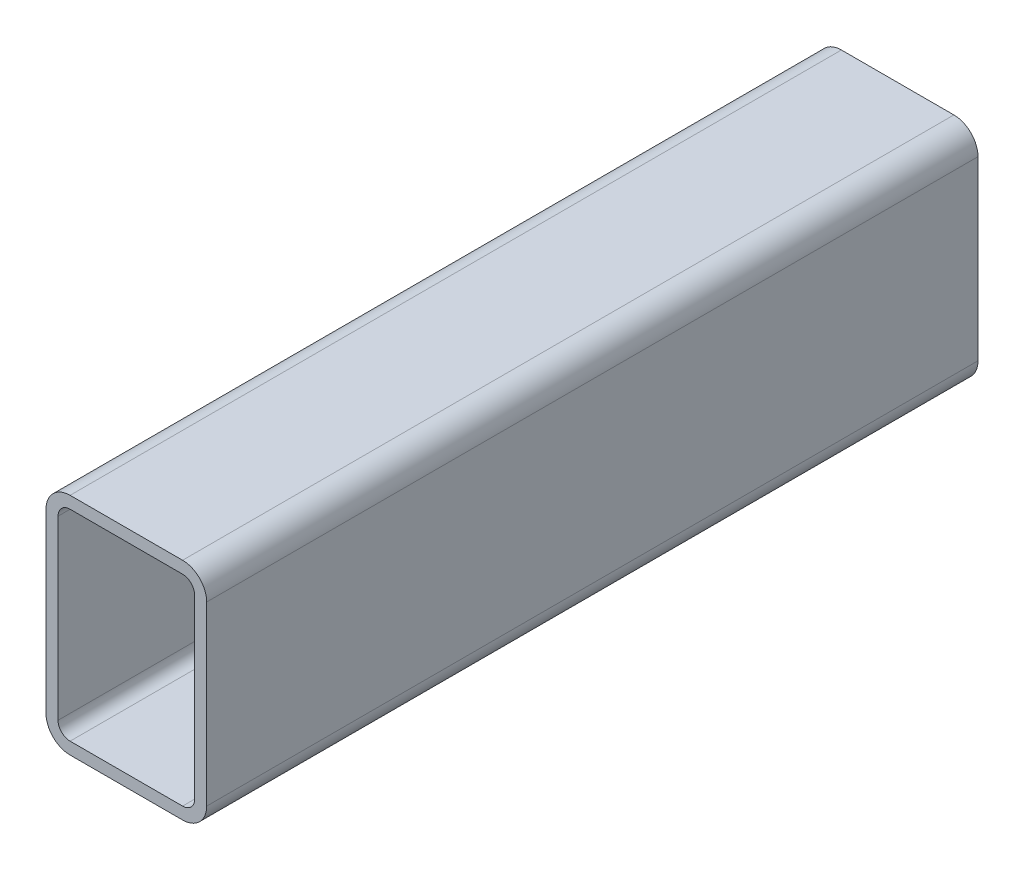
SolidWorks part; units mm, degrees
ref_plane "Front Plane" through (0, 0, 0) normal (0, 0, 1) x (1, 0, 0)
ref_plane "Top Plane" through (0, 0, 0) normal (0, 1, 0) x (1, 0, 0)
ref_plane "Right Plane" through (0, 0, 0) normal (1, 0, 0) x (0, 0, -1)
sketch "Sketch1" plane through (0, 0, 0) normal (0, 0, 1) x (1, 0, 0)
sketch_block_instance "HSS3.5x2.5x0.1875-1"
sketch_block "HSS3.5x2.5x0.1875"
extrude "Boss-Extrude1" add sketch "Sketch1" along normal blind 304.8
